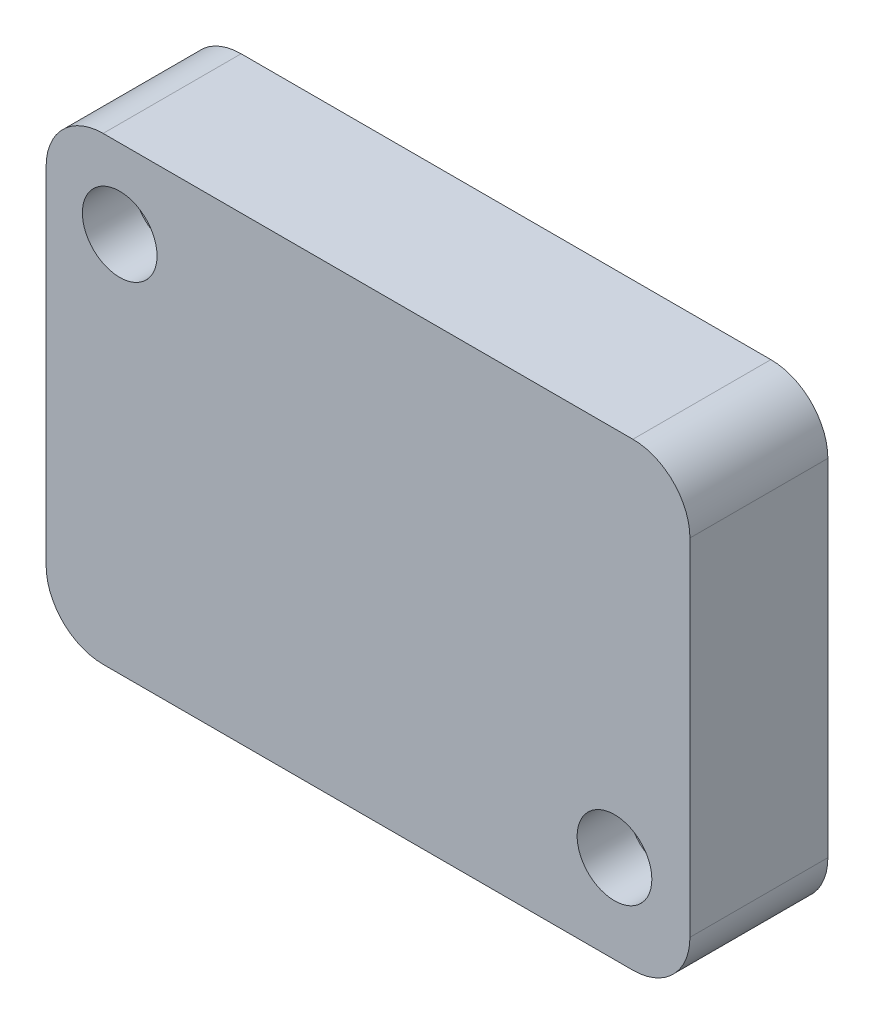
SolidWorks part; units mm, degrees
ref_plane "Top" through (0, 0, 0) normal (0, 0, 1) x (1, 0, 0)
ref_plane "Front_Back" through (0, 0, 0) normal (0, 1, 0) x (1, 0, 0)
ref_plane "Right_Left" through (0, 0, 0) normal (1, 0, 0) x (0, 0, -1)
sketch "Sketch1" plane through (0, 0, 0) normal (0, 0, 1) x (1, 0, 0)
  line L1 (-81.026, 63.5) -> (-7.874, 63.5)
  line L2 (-88.9, 55.626) -> (-88.9, 7.874)
  line L3 (-81.026, 0) -> (-7.874, 0)
  line L4 (0, 55.626) -> (0, 7.874)
  arc A0 (-81.026, 63.5) -> (-88.9, 55.626) centre (-81.026, 55.626) ccw
  arc A1 (-88.9, 7.874) -> (-81.026, 0) centre (-81.026, 7.874) ccw
  arc A2 (-7.874, 0) -> (0, 7.874) centre (-7.874, 7.874) ccw
  arc A3 (-7.874, 63.5) -> (0, 55.626) centre (-7.874, 55.626) cw
  point P6 (-88.9, 63.5)
  point P11 (0, 0)
  point P14 (0, 63.5)
  dimension "D3" = 7.874
  dimension "Depth" = 63.5
  dimension "Width" = 88.9
extrude "Die" add sketch "Sketch1" along normal blind 19.05
hole_wizard "Drill&CBore For 1/4 SHCS (Shallow)1" positions "Sketch3" profile "Sketch2" counterbore size "1/4" standard "MT&D Inch Mounting"
sketch "Sketch3" plane through (0, 0, 19.05) normal (0, 0, 1) x (1, 0, 0)
  line L0 (-7.874, 63.5) -> (-81.026, 63.5) construction
  line L1 (-88.9, 55.626) -> (-88.9, 7.874) construction
  line L2 (0, 7.874) -> (0, 55.626) construction
  line L3 (-81.026, 0) -> (-7.874, 0) construction
  point P0 (-10.414, 12.192)
  point P1 (-78.74, 52.578)
  dimension "D1" = 10.922
  dimension "D2" = 10.16
  dimension "D3" = 10.414
  dimension "D4" = 12.192
sketch "Sketch2" plane through (-10.414, 12.192, 19.05) normal (1, 0, 0) x (0, -1, 0)
  line L0 (0, 0) -> (0, 19.05)
  line L1 (0, 19.05) -> (3.5687, 19.05)
  line L2 (4.318, 19.05) -> (-43.434, 19.05) construction
  line L3 (3.5687, 19.05) -> (3.5687, 7.112)
  line L4 (3.5687, 7.112) -> (5.1562, 7.112)
  line L5 (5.1562, 7.112) -> (5.1562, 0)
  line L7 (5.1562, 0) -> (0, 0)
  line L11 (0, -6.35) -> (0, 19.05) construction
  dimension "Thru Hole Dia." = 7.1374
  dimension "Thru Hole Depth" = 19.05
  dimension "C'Bore Dia." = 10.3124
  dimension "C'Bore Depth" = 7.112
